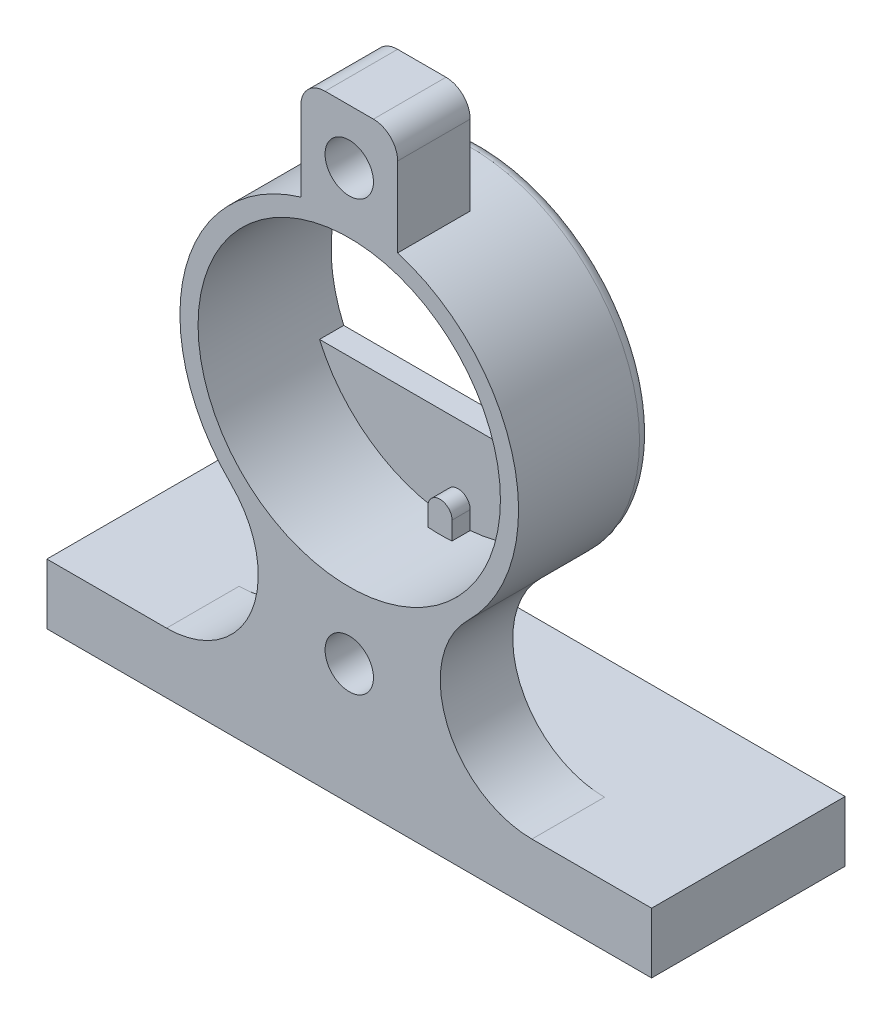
SolidWorks part; units mm, degrees
ref_plane "Alzado" through (0, 0, 0) normal (0, 0, 1) x (1, 0, 0)
ref_plane "Planta" through (0, 0, 0) normal (0, 1, 0) x (1, 0, 0)
ref_plane "Vista lateral" through (0, 0, 0) normal (1, 0, 0) x (0, 0, -1)
sketch "Croquis1" plane through (0, 0, 0) normal (0, 0, 1) x (1, 0, 0)
  line L0 (-25, -28) -> (25, -28)
  line L1 (25, -28) -> (25, -23)
  line L2 (-25, -28) -> (-25, -23)
  line L3 (0, 0) -> (0, -28) construction
  line L4 (-25, -23) -> (-15.1052, -23)
  line L5 (-15.1052, -23) -> (15.1052, -23) construction
  line L6 (15.1052, -23) -> (25, -23)
  line L7 (0, -23) -> (0, -28) construction
  line L8 (-9.798, -10) -> (9.798, -10) construction
  line L9 (0, 0) -> (0, -10) construction
  arc A0 (-9.798, -10) -> (-15.1052, -23) centre (-15.1052, -15.4167) cw
  arc A1 (9.798, -10) -> (15.1052, -23) centre (15.1052, -15.4167) ccw
  arc A2 (-9.798, -10) -> (9.798, -10) centre (0, 0) cw
  dimension "D5" = 14
  dimension "D1" = 28
  dimension "D2" = 5
  dimension "D3" = 50
  dimension "D4" = 13
extrude "Saliente-Extruir1" add sketch "Croquis1" along normal blind 11
sketch "Croquis2" plane through (0, 0, 11) normal (0, 0, 1) x (1, 0, 0)
  circle A0 centre (0, 0) radius 12.5
  arc A1 (9.798, -10) -> (-9.798, -10) centre (0, 0) ccw construction
  dimension "D1" = 1.5
extrude "Cortar-Extruir1" cut sketch "Croquis2" against normal offset from surface (9 mm away) 2
sketch "Croquis3" plane through (0, 0, 2) normal (0, 0, 1) x (1, 0, 0)
  line L0 (-11.4564, -5) -> (11.4564, -5)
  line L1 (-11.4564, -5) -> (-11.4564, 5) construction
  line L2 (-11.4564, 5) -> (11.4564, 5)
  line L3 (11.4564, -5) -> (11.4564, 5) construction
  line L4 (-11.4564, 0) -> (0, 0) construction
  line L5 (0, 0) -> (11.4564, 0) construction
  circle A0 centre (0, 0) radius 12.5 construction
  circle A1 centre (0, 0) radius 12.5 construction
  arc A2 (-11.4564, -5) -> (-11.4564, 5) centre (0, 0) cw
  arc A3 (11.4564, -5) -> (11.4564, 5) centre (0, 0) ccw
  dimension "D1" = 10
extrude "Cortar-Extruir2" cut sketch "Croquis3" against normal through all
sketch "Croquis4" plane through (0, 0, 0) normal (0, 0, -1) x (-1, 0, 0)
  line L0 (-11.8216, -7.5) -> (11.8216, -7.5) construction
  line L1 (-11.8216, -7.5) -> (-25, -23)
  line L2 (-25, -23) -> (-25, -28)
  line L3 (-25, -28) -> (25, -28)
  line L4 (25, -28) -> (25, -23)
  line L5 (25, -23) -> (11.8216, -7.5)
  arc A0 (-11.8216, -7.5) -> (11.8216, -7.5) centre (0, 0) ccw
  arc A1 (9.798, -10) -> (-9.798, -10) centre (0, 0) ccw construction
  dimension "D1" = 7.5
extrude "Cortar-Extruir3" cut sketch "Croquis4" against normal blind 5
sketch "Croquis5" plane through (0, 0, 11) normal (0, 0, 1) x (1, 0, 0)
  line L0 (0, -28) -> (0, -18) construction
  line L1 (-25, -28) -> (25, -28) construction
  circle A0 centre (0, -18) radius 2
  dimension "D2" = 4
  dimension "D1" = 10
extrude "Cortar-Extruir4" cut sketch "Croquis5" against normal through all
fillet "Redondeo1" radius 1 1 edges at (-14, 0, 0)
sketch "Croquis7" plane through (0, 0, 11) normal (0, 0, 1) x (1, 0, 0)
  line L0 (-4, 13.4164) -> (-4, 20)
  line L1 (-2, 22) -> (2, 22)
  line L2 (4, 20) -> (4, 13.4164)
  line L3 (0, 22) -> (0, 0) construction
  arc A0 (9.798, -10) -> (-9.798, -10) centre (0, 0) ccw construction
  arc A1 (4, 13.4164) -> (-4, 13.4164) centre (0, 0) ccw
  circle A2 centre (0, 17.5) radius 2
  arc A4 (2, 22) -> (4, 20) centre (2, 20) cw
  arc A5 (-4, 20) -> (-2, 22) centre (-2, 20) cw
  point P15 (4, 22)
  point P18 (-4, 22)
  dimension "D3" = 4
  dimension "D4" = 2
  dimension "D1" = 22
  dimension "D2" = 8
  dimension "D5" = 4.5
extrude "Saliente-Extruir2" add sketch "Croquis7" against normal up to surface (6 mm away)
sketch "Croquis6" plane through (0, 0, 5) normal (0, 0, -1) x (-1, 0, 0)
  circle A0 centre (0, -18) radius 3.25
  circle A1 centre (0, 17.5) radius 3.25
  dimension "D1" = 6.5
  dimension "D2" = 6.5
extrude "Cortar-Extruir5" cut sketch "Croquis6" against normal blind 2
sketch "Croquis8" plane through (0, 0, 2) normal (0, 0, 1) x (1, 0, 0)
  line L0 (0, -10.9642) -> (0, 0) construction
  line L1 (-1, -13.9642) -> (-1, -10.9642)
  line L2 (-1, -13.9642) -> (1, -13.9642)
  line L3 (1, -13.9642) -> (1, -10.9642)
  line L4 (-1, -10.9642) -> (1, -10.9642) construction
  line L5 (-1, 13.9642) -> (-1, 10.9642)
  line L6 (-1, 13.9642) -> (1, 13.9642)
  line L7 (1, 13.9642) -> (1, 10.9642)
  line L8 (-1, 10.9642) -> (1, 10.9642) construction
  arc A0 (-4, 13.4164) -> (-9.798, -10) centre (0, 0) ccw construction
  arc A1 (9.798, -10) -> (4, 13.4164) centre (0, 0) ccw construction
  arc A2 (-1, -10.9642) -> (1, -10.9642) centre (0, -10.9642) cw
  arc A3 (-1, 10.9642) -> (1, 10.9642) centre (0, 10.9642) ccw
  dimension "D1" = 2
  dimension "D2" = 3
  dimension "D3" = 3
extrude "Saliente-Extruir3" add sketch "Croquis8" along normal blind 1.5
sketch "Croquis9" plane through (0, 0, 5) normal (0, 0, -1) x (-1, 0, 0)
  line L1 (-25, -28) -> (25, -28)
  line L2 (-25, -28) -> (-25, -23)
  line L3 (-25, -23) -> (25, -23)
  line L4 (25, -28) -> (25, -23)
extrude "Saliente-Extruir4" add sketch "Croquis9" along normal blind 10
